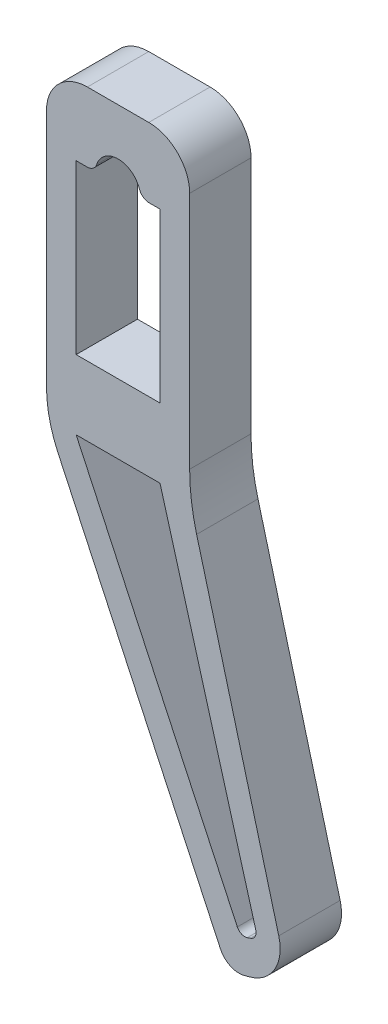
SolidWorks part; units mm, degrees
ref_plane "Front Plane" through (0, 0, 0) normal (0, 0, 1) x (1, 0, 0)
ref_plane "Top Plane" through (0, 0, 0) normal (0, 1, 0) x (1, 0, 0)
ref_plane "Right Plane" through (0, 0, 0) normal (1, 0, 0) x (0, 0, -1)
sketch "Sketch4" plane through (0, 0, 0) normal (0, 0, 1) x (1, 0, 0)
  line L1 (-17.5, -37.5) -> (17.5, -37.5)
  line L2 (-17.5, -37.5) -> (-17.5, 37.5)
  line L3 (-17.5, 37.5) -> (17.5, 37.5)
  line L4 (17.5, -37.5) -> (17.5, 37.5)
  line L5 (-17.5, -37.5) -> (17.5, 37.5) construction
  line L6 (-17.5, 37.5) -> (17.5, -37.5) construction
  point P0 (0, 0)
  dimension "D1" = 75
  dimension "D2" = 35
extrude "Boss-Extrude2" add sketch "Sketch4" along normal blind 15
sketch "Sketch5" plane through (0, 0, 15) normal (0, 0, 1) x (1, 0, 0)
  line L0 (-17.5, -37.5) -> (26.7992, -132.5)
  line L1 (41.8729, -128.461) -> (17.5, -37.5)
  line L2 (17.5, -37.5) -> (-17.5, -37.5)
  line L3 (17.5, -37.5) -> (17.5, 37.5) construction
  line L4 (26.7992, -132.5) -> (41.8729, -128.461)
  dimension "D1" = 95
  dimension "D2" = 165
  dimension "D3" = 100
extrude "Boss-Extrude3" add sketch "Sketch5" against normal blind 15
sketch "Sketch7" plane through (0, 0, 15) normal (0, 0, 1) x (1, 0, 0)
  line L1 (-10.25, -20.525) -> (10.25, -20.525)
  line L2 (-10.25, -20.525) -> (-10.25, 20.525)
  line L3 (-10.25, 20.525) -> (10.25, 20.525)
  line L4 (10.25, -20.525) -> (10.25, 20.525)
  line L5 (-10.25, -20.525) -> (10.25, 20.525) construction
  line L6 (-10.25, 20.525) -> (10.25, -20.525) construction
  point P0 (0, 0)
  dimension "D1" = 20.5
  dimension "D2" = 41.05
extrude "Cut-Extrude2" cut sketch "Sketch7" against normal through all
sketch "Sketch11" plane through (0, 0, 15) normal (0, 0, 1) x (1, 0, 0)
  line L0 (10.25, 20.525) -> (-10.25, 20.525) construction
  line L1 (-5.5, 20.525) -> (5.5, 20.525)
  arc A0 (5.5, 20.525) -> (-5.5, 20.525) centre (0, 20.525) ccw
  dimension "D1" = 11
extrude "Cut-Extrude4" cut sketch "Sketch11" against normal through all
sketch "Sketch14" plane through (0, 0, 15) normal (0, 0, 1) x (1, 0, 0)
  line L0 (-10.25, -37.5) -> (10.25, -37.5)
  line L1 (-10.25, -20.525) -> (10.25, -20.525) construction
  line L3 (10.25, -37.5) -> (29.8987, -123.5992)
  line L4 (29.8987, -123.5992) -> (-10.25, -37.5)
  line L6 (-17.5, -37.5) -> (26.7992, -132.5) construction
  dimension "D1" = 95
extrude "Cut-Extrude5" cut sketch "Sketch14" against normal through all
sketch "Sketch15" plane through (0, 0, 15) normal (0, 0, 1) x (1, 0, 0)
  line L0 (10.25, -37.5) -> (34.1712, -122.1863)
  line L1 (34.1712, -122.1863) -> (29.8987, -123.5992)
  line L2 (10.25, -37.5) -> (29.8987, -123.5992)
  dimension "D1" = 88
  dimension "D2" = 4.5
extrude "Cut-Extrude6" cut sketch "Sketch15" against normal through all
fillet "Fillet1" radius 10 1 edges at (41.8729, -128.461, 7.5)
fillet "Fillet2" radius 5 1 edges at (26.7992, -132.5, 7.5)
fillet "Fillet3" radius 30 1 edges at (-17.5, -37.5, 7.5)
fillet "Fillet4" radius 50 1 edges at (17.5, -37.5, 7.5)
fillet "Fillet6" radius 2 2 edges at (29.8987, -123.5992, 7.5) (34.1712, -122.1863, 7.5)
fillet "Fillet5" radius 10 2 edges at (-17.5, 37.5, 7.5) (17.5, 37.5, 7.5)
fillet "Fillet7" radius 2.5 2 edges at (-5.5, 20.525, 7.5) (5.5, 20.525, 7.5)
